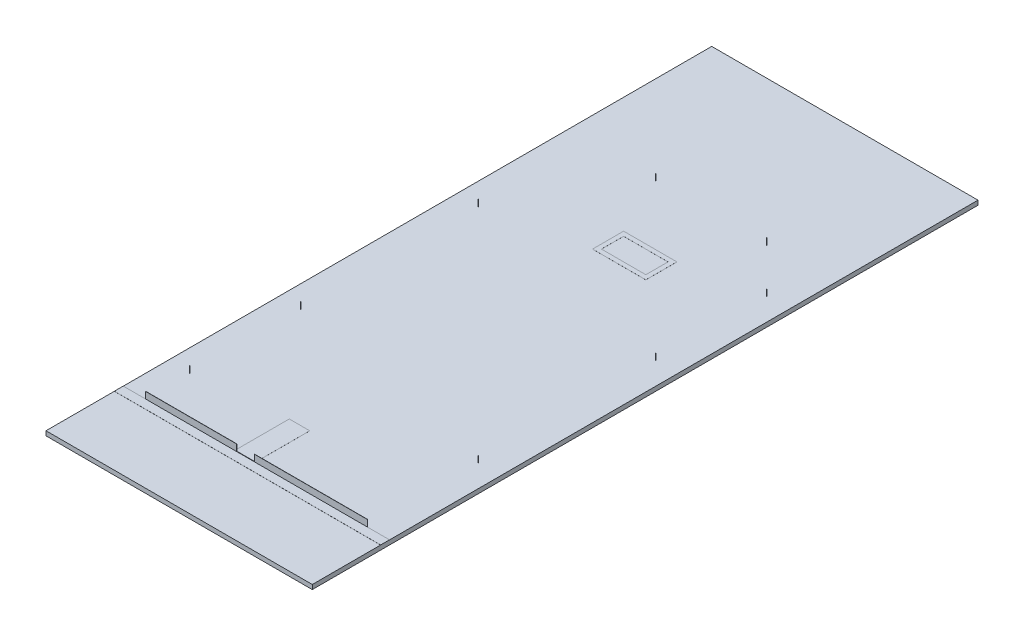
SolidWorks part; units mm, degrees
ref_plane "Plan de face" through (0, 0, 0) normal (0, 0, 1) x (1, 0, 0)
ref_plane "Plan de dessus" through (0, 0, 0) normal (0, 1, 0) x (1, 0, 0)
ref_plane "Plan de droite" through (0, 0, 0) normal (1, 0, 0) x (0, 0, -1)
sketch "Esquisse1" plane through (0, 0, 0) normal (0, 1, 0) x (1, 0, 0)
  line L1 (-30000, 0) -> (30000, 0)
  line L2 (-30000, 0) -> (-30000, 150000)
  line L3 (-30000, 150000) -> (30000, 150000)
  line L4 (30000, 0) -> (30000, 150000)
  dimension "D1" = 60000
  dimension "D2" = 150000
  dimension "D3" = 30000
extrude "Boss.-Extru.1" add sketch "Esquisse1" along normal blind 1000
sketch "Esquisse2" plane through (0, 1000, 0) normal (0, 1, 0) x (1, 0, 0)
  line L0 (-30000, 0) -> (30000, 0) construction
  line L1 (-25000, 17394.4545) -> (25000, 17394.4545)
  line L2 (-25000, 17394.4545) -> (-25000, 117394.4545)
  line L3 (-25000, 117394.4545) -> (25000, 117394.4545)
  line L4 (25000, 17394.4545) -> (25000, 117394.4545)
  point P4 (0, 0)
  dimension "D1" = 50000
  dimension "D2" = 25000
  dimension "D3" = 100000
sketch "Esquisse3" plane through (0, 1000, 0) normal (0, 1, 0) x (1, 0, 0)
  line L0 (-30000, 150000) -> (-30000, 0) construction
  line L1 (-30000, 17394.4545) -> (30000, 17394.4545)
  line L2 (-30000, 17394.4545) -> (-30000, 15394.4545)
  line L3 (-30000, 15394.4545) -> (30000, 15394.4545)
  line L4 (30000, 17394.4545) -> (30000, 15394.4545)
  line L5 (30000, 0) -> (30000, 150000) construction
  line L6 (-25000, 17394.4545) -> (25000, 17394.4545) construction
  dimension "D1" = 2000
extrude "trottoir" add sketch "Esquisse3" along normal blind 20
sketch "Esquisse4" plane through (0, 1000, 0) normal (0, 1, 0) x (1, 0, 0)
  line L0 (25000, 17394.4545) -> (25000, 117394.4545) construction
  line L1 (-25000, 17394.4545) -> (25000, 17394.4545)
  line L2 (-25000, 17394.4545) -> (-25000, 17434.4545)
  line L3 (-25000, 17434.4545) -> (25000, 17434.4545)
  line L4 (25000, 17394.4545) -> (25000, 17434.4545)
  dimension "D1" = 40
extrude "mur" add sketch "Esquisse4" along normal blind 1500
sketch "Esquisse5" plane through (0, 1000, 0) normal (0, 1, 0) x (1, 0, 0)
  circle A0 centre (25000, 17394.4545) radius 5
  dimension "D1" = 10
extrude "piquet" add sketch "Esquisse5" along normal blind 1500
pattern_linear "Répétition linéaire1" count 21 spacing 5000 along (0, 0, -1) count 2 spacing 50000 along (-1, 0, 0) of "piquet"
sketch "Esquisse6" plane through (0, 1000, 0) normal (0, 1, 0) x (1, 0, 0)
  circle A0 centre (-25000, 117394.4545) radius 5
extrude "piquet fond" add sketch "Esquisse6" along normal blind 1500
pattern_linear "Répétition linéaire2" count 10 spacing 5000 along (1, 0, 0) of "piquet fond"
sketch "Esquisse7" plane through (0, 2500, 0) normal (0, 1, 0) x (1, 0, 0)
  line L1 (-4447.7774, 17813.1482) -> (-433.2378, 17813.1482)
  line L2 (-4447.7774, 17813.1482) -> (-4447.7774, 17191.5679)
  line L3 (-4447.7774, 17191.5679) -> (-433.2378, 17191.5679)
  line L4 (-433.2378, 17813.1482) -> (-433.2378, 17191.5679)
extrude "Enlèv. mat.-Extru.1" cut sketch "Esquisse7" against normal blind 1400
sketch "Esquisse8" plane through (0, 1000, 0) normal (0, 1, 0) x (1, 0, 0)
  line L1 (-3862.8213, 104014.4257) -> (8137.1787, 104014.4257)
  line L2 (-3862.8213, 104014.4257) -> (-3862.8213, 97014.4257)
  line L3 (-3862.8213, 97014.4257) -> (8137.1787, 97014.4257)
  line L4 (8137.1787, 104014.4257) -> (8137.1787, 97014.4257)
  dimension "D1" = 12000
  dimension "D2" = 7000
extrude "Boss.-Extru.2" add sketch "Esquisse8" along normal blind 10
sketch "Esquisse10" plane through (0, 1010, 0) normal (0, 1, 0) x (1, 0, 0)
  line L0 (-2862.8213, 103014.4257) -> (-2862.8213, 98014.4257)
  line L1 (-2862.8213, 98014.4257) -> (7137.1787, 98014.4257)
  line L2 (7137.1787, 98014.4257) -> (7137.1787, 103014.4257)
  line L3 (7137.1787, 103014.4257) -> (-2862.8213, 103014.4257)
extrude "Enlèv. mat.-Extru.2" cut sketch "Esquisse10" against normal blind 10
sketch "Esquisse11" plane through (0, 1000, 0) normal (0, 1, 0) x (1, 0, 0)
  line L0 (25000, 17434.4545) -> (-25000, 17434.4545) construction
  line L1 (-4881.5812, 17434.4545) -> (-267.2577, 17434.4545)
  line L2 (-4881.5812, 17434.4545) -> (-4881.5812, 29694.0131)
  line L3 (-4881.5812, 29694.0131) -> (-267.2577, 29694.0131)
  line L4 (-267.2577, 17434.4545) -> (-267.2577, 29694.0131)
extrude "Boss.-Extru.3" add sketch "Esquisse11" along normal blind 10
